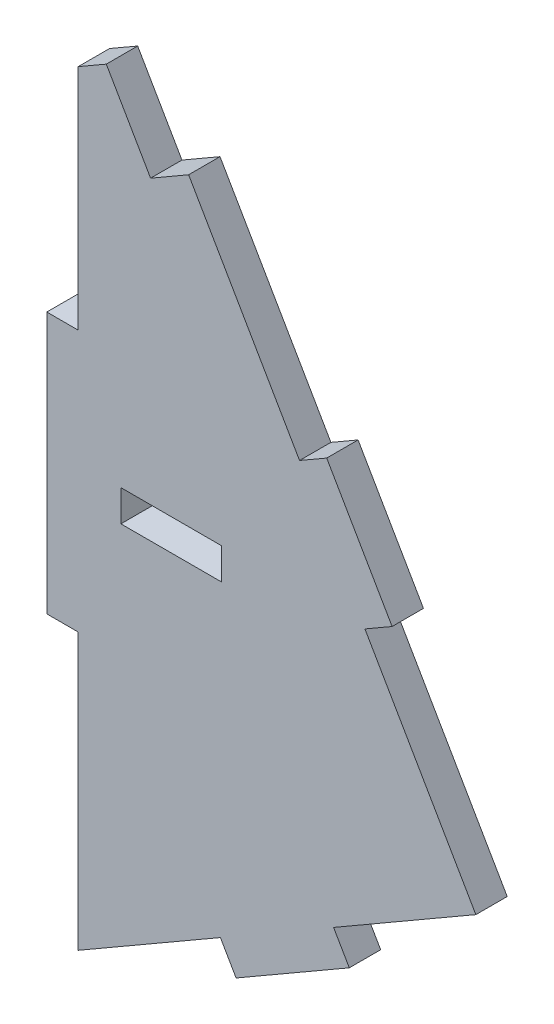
SolidWorks part; units mm, degrees
ref_plane "Front Plane" through (0, 0, 0) normal (0, 0, 1) x (1, 0, 0)
ref_plane "Top Plane" through (0, 0, 0) normal (0, 1, 0) x (1, 0, 0)
ref_plane "Right Plane" through (0, 0, 0) normal (1, 0, 0) x (0, 0, -1)
sketch "Sketch1" plane through (0, 0, 0) normal (0, 0, 1) x (1, 0, 0)
  line L0 (1.524, -7.869) -> (0, -7.869)
  line L1 (0, -7.869) -> (0, 4.831)
  line L2 (0, 4.831) -> (1.524, 4.831)
  line L3 (1.524, 4.831) -> (1.524, 15.9158)
  line L4 (1.524, 15.9158) -> (2.8908, 16.7054)
  line L6 (2.8908, 16.7054) -> (5.0417, 12.9822)
  line L7 (5.0417, 12.9822) -> (6.8902, 14.0501)
  line L8 (6.8902, 14.0501) -> (12.2779, 4.724)
  line L9 (20.8421, -10.1005) -> (13.9322, -14.0923)
  line L11 (1.524, -21.2606) -> (1.524, -7.869)
  line L12 (15.4543, -0.7744) -> (20.8421, -10.1005)
  line L13 (3.5995, -2.281) -> (8.4953, -2.281)
  line L14 (3.5995, -0.757) -> (8.4953, -0.757)
  line L15 (3.5995, -2.281) -> (3.5995, -0.757)
  line L16 (8.4953, -2.281) -> (8.4953, -0.757)
  line L17 (8.4338, -17.2688) -> (1.524, -21.2606)
  line L18 (8.4338, -17.2688) -> (9.1962, -18.5884)
  line L19 (13.9322, -14.0923) -> (14.6946, -15.412)
  line L21 (9.1962, -18.5884) -> (14.6946, -15.412)
  line L23 (15.4543, -0.7744) -> (16.774, -0.0121)
  line L24 (12.2779, 4.724) -> (13.5975, 5.4863)
  line L26 (16.774, -0.0121) -> (13.5975, 5.4863)
extrude "Boss-Extrude1" add sketch "Sketch1" along normal blind 1.524
